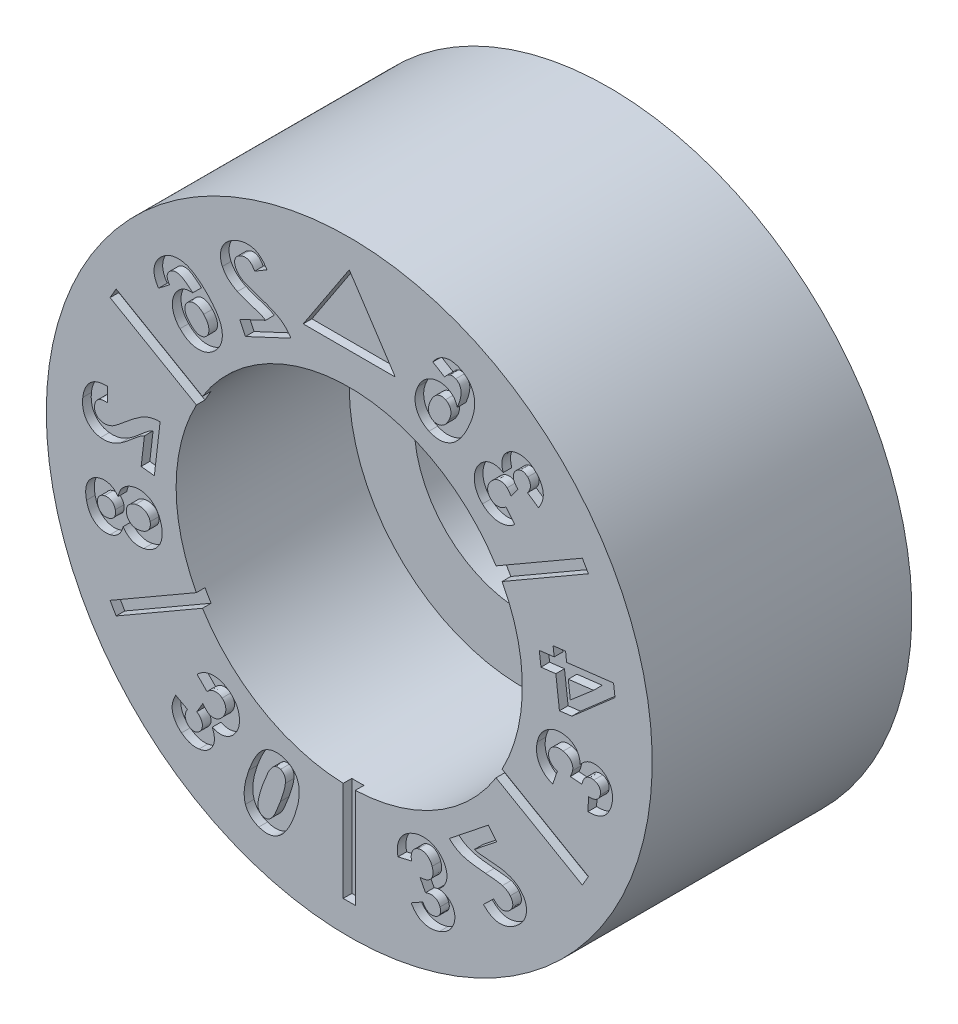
SolidWorks part; units mm, degrees
ref_plane "Front Plane" through (0, 0, 0) normal (0, 0, 1) x (1, 0, 0)
ref_plane "Top Plane" through (0, 0, 0) normal (0, 1, 0) x (1, 0, 0)
ref_plane "Right Plane" through (0, 0, 0) normal (1, 0, 0) x (0, 0, -1)
imported_body "Imported1"
other "Move Face1" parameters "D1"=0.22
other "DeleteFace2"
sketch "Sketch1" plane through (0, 0, 0) normal (0, 0, 1) x (1, 0, 0)
  line L0 (0, 0) -> (0, -3.9447) construction
  line L2 (-0.07, -1.65) -> (0.07, -1.65)
  line L3 (-0.07, -1.65) -> (-0.07, -3.15)
  line L4 (-0.07, -3.15) -> (0.07, -3.15)
  line L5 (0.07, -1.65) -> (0.07, -3.15)
  line L9 (0, 0) -> (-1.9723, -3.4162) construction
  line L10 (-1.4639, -0.7644) -> (-1.3939, -0.8856)
  line L11 (-1.3939, -0.8856) -> (-2.693, -1.6356)
  line L12 (-1.4639, -0.7644) -> (-2.763, -1.5144)
  line L13 (-2.763, -1.5144) -> (-2.693, -1.6356)
  line L14 (0, 0) -> (-3.4162, -1.9723) construction
  line L19 (0, 0) -> (-3.9447, 0) construction
  line L20 (-1.3939, 0.8856) -> (-1.4639, 0.7644)
  line L21 (-1.4639, 0.7644) -> (-2.763, 1.5144)
  line L22 (-1.3939, 0.8856) -> (-2.693, 1.6356)
  line L23 (-2.693, 1.6356) -> (-2.763, 1.5144)
  line L24 (0, 0) -> (-3.4162, 1.9723) construction
  line L29 (0, 0) -> (-1.9723, 3.4162) construction
  line L34 (0, 0) -> (0, 3.9447) construction
  line L39 (0, 0) -> (1.9723, 3.4162) construction
  line L40 (1.4639, 0.7644) -> (1.3939, 0.8856)
  line L41 (1.3939, 0.8856) -> (2.693, 1.6356)
  line L42 (1.4639, 0.7644) -> (2.763, 1.5144)
  line L43 (2.763, 1.5144) -> (2.693, 1.6356)
  line L44 (0, 0) -> (3.4162, 1.9723) construction
  line L49 (0, 0) -> (3.9447, 0) construction
  line L50 (1.3939, -0.8856) -> (1.4639, -0.7644)
  line L51 (1.4639, -0.7644) -> (2.763, -1.5144)
  line L52 (1.3939, -0.8856) -> (2.693, -1.6356)
  line L53 (2.693, -1.6356) -> (2.763, -1.5144)
  line L54 (0, 0) -> (3.4162, -1.9723) construction
  line L59 (0, 0) -> (1.9723, -3.4162) construction
  line L60 (0.07, 3.15) -> (-0.07, 3.15)
  line L61 (0.07, 1.65) -> (0.07, 3.15)
  line L62 (-0.07, 1.65) -> (-0.07, 3.15)
  line L63 (0.07, 1.65) -> (-0.07, 1.65)
  line L64 (-0.7644, 1.4639) -> (-1.5144, 2.763)
  line L65 (-1.5144, 2.763) -> (-1.6356, 2.693)
  line L66 (-0.8856, 1.3939) -> (-1.6356, 2.693)
  line L67 (-0.7644, 1.4639) -> (-0.8856, 1.3939)
  line L68 (0.8856, 1.3939) -> (1.6356, 2.693)
  line L69 (0.8856, 1.3939) -> (0.7644, 1.4639)
  line L70 (0.7644, 1.4639) -> (1.5144, 2.763)
  line L71 (-1.65, 0.07) -> (-3.15, 0.07)
  line L72 (-1.65, -0.07) -> (-3.15, -0.07)
  line L73 (-3.15, 0.07) -> (-3.15, -0.07)
  line L74 (-1.65, 0.07) -> (-1.65, -0.07)
  line L75 (1.65, 0.07) -> (3.15, 0.07)
  line L76 (3.15, -0.07) -> (3.15, 0.07)
  line L77 (1.65, -0.07) -> (3.15, -0.07)
  line L78 (1.65, -0.07) -> (1.65, 0.07)
  line L79 (-0.7644, -1.4639) -> (-1.5144, -2.763)
  line L80 (-0.8856, -1.3939) -> (-1.6356, -2.693)
  line L81 (-1.6356, -2.693) -> (-1.5144, -2.763)
  line L82 (-0.8856, -1.3939) -> (-0.7644, -1.4639)
  line L83 (0.8856, -1.3939) -> (1.6356, -2.693)
  line L84 (0.7644, -1.4639) -> (1.5144, -2.763)
  line L85 (0.7644, -1.4639) -> (0.8856, -1.3939)
  line L86 (1.5144, -2.763) -> (1.6356, -2.693)
  line L87 (1.6356, 2.693) -> (1.5144, 2.763)
  arc A0 (-0.6463, 2.1656) -> (0, 2.26) centre (0, 0) ccw construction
  text T0 "26  28  30  32  34  36" font "Arial" height 0.87
  point P66 (0, 0)
  dimension "D1" = 4.52
  dimension "D6" = 12
extrude "Cut-Extrude1" cut sketch "Sketch1" against normal blind 0.1
other "Move Face3" parameters "D1"=1
other "Move Face2" parameters "D1"=2
sketch "Sketch2" plane through (0, 0, 0) normal (0, 1, 0) x (1, 0, 0)
  line L0 (3.5, 3) -> (-3.5, 3) construction
  line L1 (-2.2, 3) -> (-2.8, 3)
  arc A0 (-2.8, 3) -> (-2.2, 3) centre (-2.5, 3) cw
  dimension "D2" = 0.3
  dimension "D1" = 2.5
revolve "Revolve1" add sketch "Sketch2" angle 360 about L1
